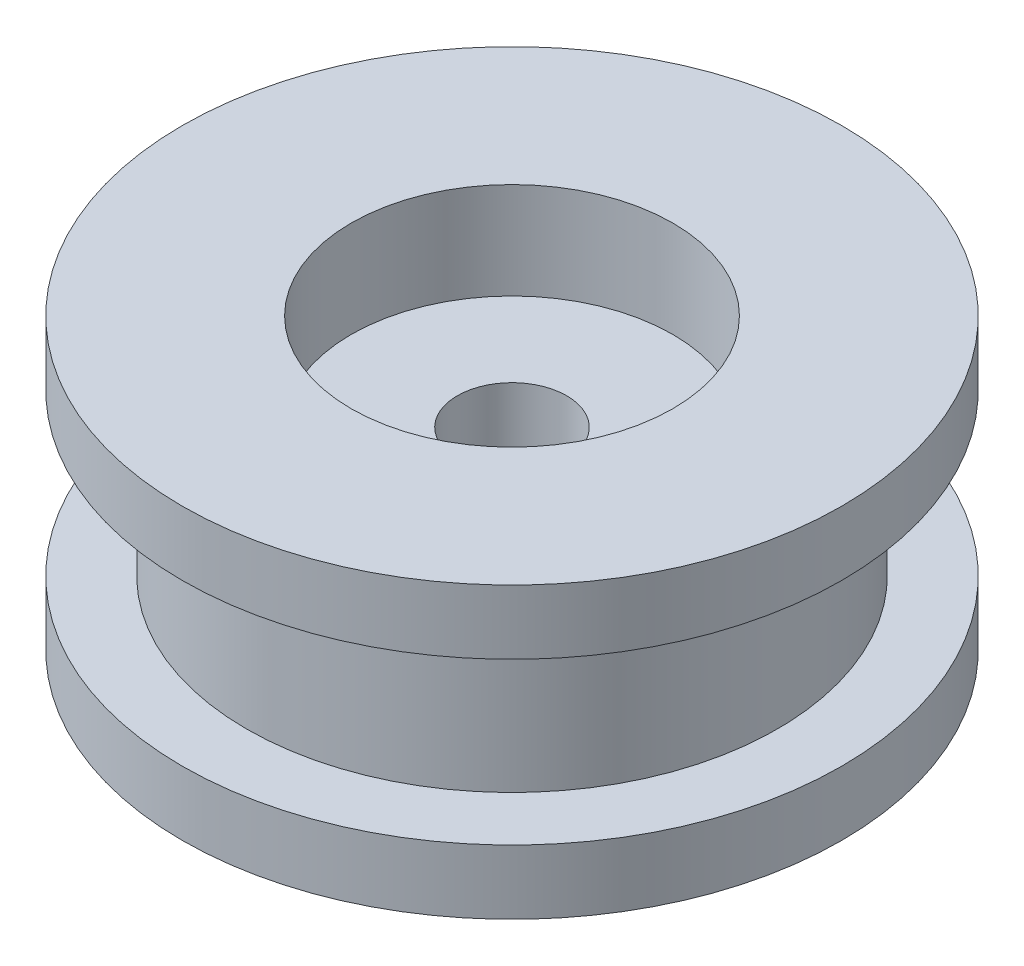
SolidWorks part; units mm, degrees
ref_plane "Plan de face" through (0, 0, 0) normal (0, 0, 1) x (1, 0, 0)
ref_plane "Plan de dessus" through (0, 0, 0) normal (0, 1, 0) x (1, 0, 0)
ref_plane "Plan de droite" through (0, 0, 0) normal (1, 0, 0) x (0, 0, -1)
sketch "Esquisse1" plane through (0, 0, 0) normal (0, 0, 1) x (1, 0, 0)
  line L0 (-61.5, 50) -> (-61.5, 54)
  line L1 (-51, 36) -> (-61.5, 36)
  line L2 (-41, 42) -> (-41, 48)
  line L3 (-51, 54) -> (-61.5, 54)
  line L4 (-61.5, 36) -> (-61.5, 40)
  line L5 (-61.5, 50) -> (-57.5, 50)
  line L7 (-61.5, 40) -> (-57.5, 40)
  line L8 (-57.5, 50) -> (-57.5, 40)
  line L11 (-41, 48) -> (-51, 48)
  line L12 (-51, 54) -> (-51, 48)
  line L15 (-41, 42) -> (-51, 42)
  line L16 (-51, 36) -> (-51, 42)
  dimension "D1" = 20.5
  dimension "D2" = 18
  dimension "D3" = 4
  dimension "D4" = 10
  dimension "D5" = 4
  dimension "D6" = 10
  dimension "D7" = 10
  dimension "D8" = 6
  dimension "D9" = 6
revolve "Révolution1" add sketch "Esquisse1" angle 360 about L2
hole_wizard "Trou taraudé M81" positions "Esquisse3D1" profile "Esquisse2" tap size "M8" standard "ISO"
sketch3d "Esquisse3D1"
  circle A0 centre (-41, 42, 0) radius 10 construction
  point P0 (-41, 42, 0)
  point P14 (-41, 32, 0)
sketch "Esquisse2" plane through (-41, 42, 0) normal (1, 0, 0) x (0, 0, -1)
  line L0 (0, 0) -> (0, 12)
  line L1 (0, 12) -> (3.4, 12)
  line L2 (3.4, 12) -> (3.4, 0)
  line L5 (3.4, 0) -> (0, 0)
  line L11 (0, -6.35) -> (0, 107.95) construction
  dimension "Diamètre du trou pour taraudage jusqu'au prochain" = 6.8
  dimension "Profondeur du trou pour taraudage jusqu'au prochain" = 12
